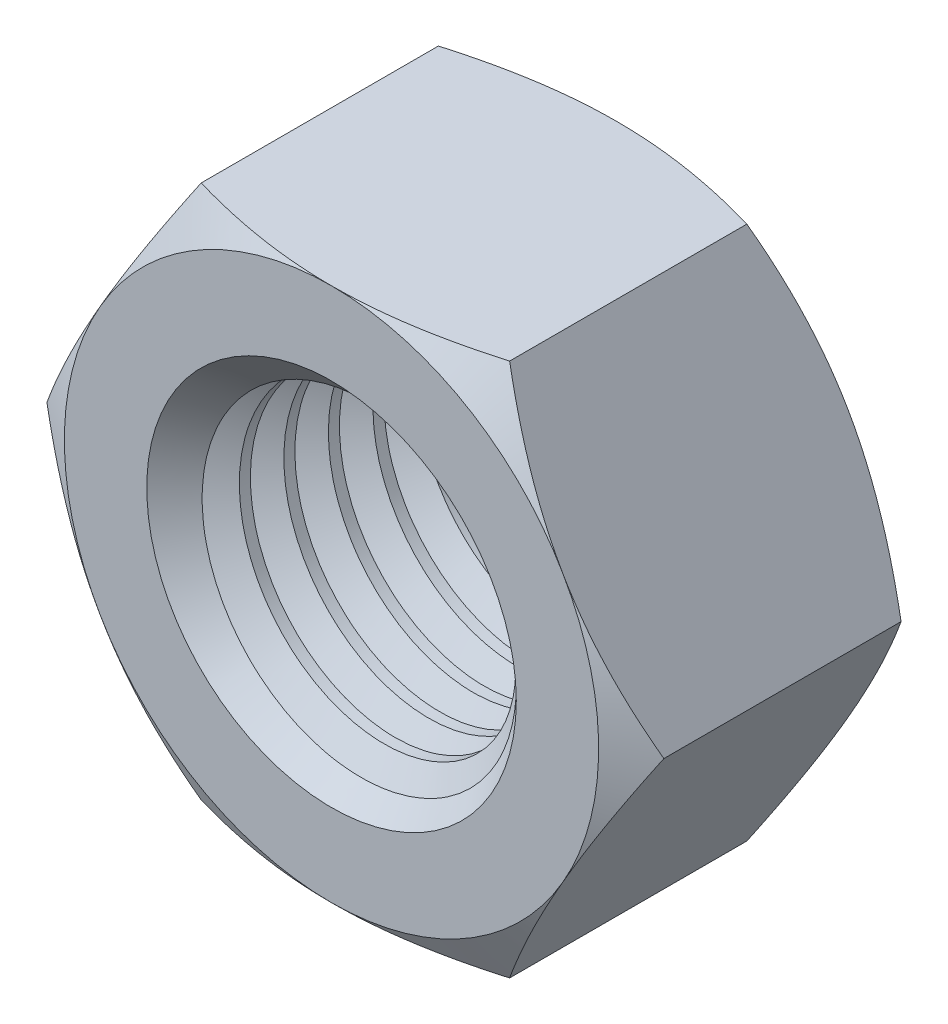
SolidWorks part; units mm, degrees
ref_plane "Front" through (0, 0, 0) normal (0, 0, 1) x (1, 0, 0)
ref_plane "Top" through (0, 0, 0) normal (0, 1, 0) x (1, 0, 0)
ref_plane "Right" through (0, 0, 0) normal (1, 0, 0) x (0, 0, -1)
sketch "Çizim1" plane through (0, 0, 0) normal (0, 0, 1) x (1, 0, 0)
  line L1 (17.3205, 0) -> (8.6603, 15)
  line L2 (8.6603, 15) -> (-8.6603, 15)
  line L3 (-8.6603, 15) -> (-17.3205, 0)
  line L4 (-17.3205, 0) -> (-8.6603, -15)
  line L5 (-8.6603, -15) -> (8.6603, -15)
  line L6 (8.6603, -15) -> (17.3205, 0)
  circle A0 centre (0, 0) radius 15 construction
  point P1 (0, 0)
  dimension "D1" = 30
extrude "Yükseklik-Ekstrüzyon1" add sketch "Çizim1" along normal blind 16
sketch "Çizim2" plane through (0, 0, 16) normal (0, 0, 1) x (1, 0, 0)
  circle A0 centre (0, 0) radius 15
extrude "Kes-Ekstrüzyon1" cut sketch "Çizim2" against normal blind 16 draft 60 flip side to cut
sketch "Çizim3" plane through (0, 0, 0) normal (0, 0, -1) x (-1, 0, 0)
  circle A0 centre (0, 0) radius 15
extrude "Kes-Ekstrüzyon2" cut sketch "Çizim3" against normal blind 16 draft 60 flip side to cut
sketch "Çizim4" plane through (0, 0, 0) normal (0, 0, -1) x (-1, 0, 0)
  circle A0 centre (0, 0) radius 8.375
  dimension "D1" = 16.75
extrude "Kes-Ekstrüzyon3" cut sketch "Çizim4" against normal blind 16
chamfer "Pah1" distance 2 angle 45 2 edges at (-8.375, 0, 16) (-8.375, 0, 0)
sketch "Çizim5" plane through (0, 0, 0) normal (0, 0, -1) x (-1, 0, 0)
  circle A0 centre (0, 0) radius 8.375
  dimension "D1" = 16.75
curve "Helis/Spiral1"
ref_plane "Düzlem1" through (-6.7755, -4.9227, 19) normal (0.5871, -0.8081, 0.0475) x (-0.8095, -0.5861, 0.0344)
sketch "Çizim6" plane through (-6.7755, -4.9227, 19) normal (0.5871, -0.8081, 0.0475) x (-0.8095, -0.5861, 0.0344)
  line L0 (-0.4989, -1.2262) -> (-0.4989, 1.2262)
  line L1 (1.625, 0) -> (-0.4989, 1.2262)
  line L3 (-0.4989, -1.2262) -> (1.625, 0)
  line L5 (-0.8125, 1.4073) -> (-0.8125, 0)
  circle A0 centre (0, 0) radius 0.8125 construction
  dimension "D1" = 1.625
sweep "Kes-Süpür1" cut profiles "Çizim6" path "Helis/Spiral1"
